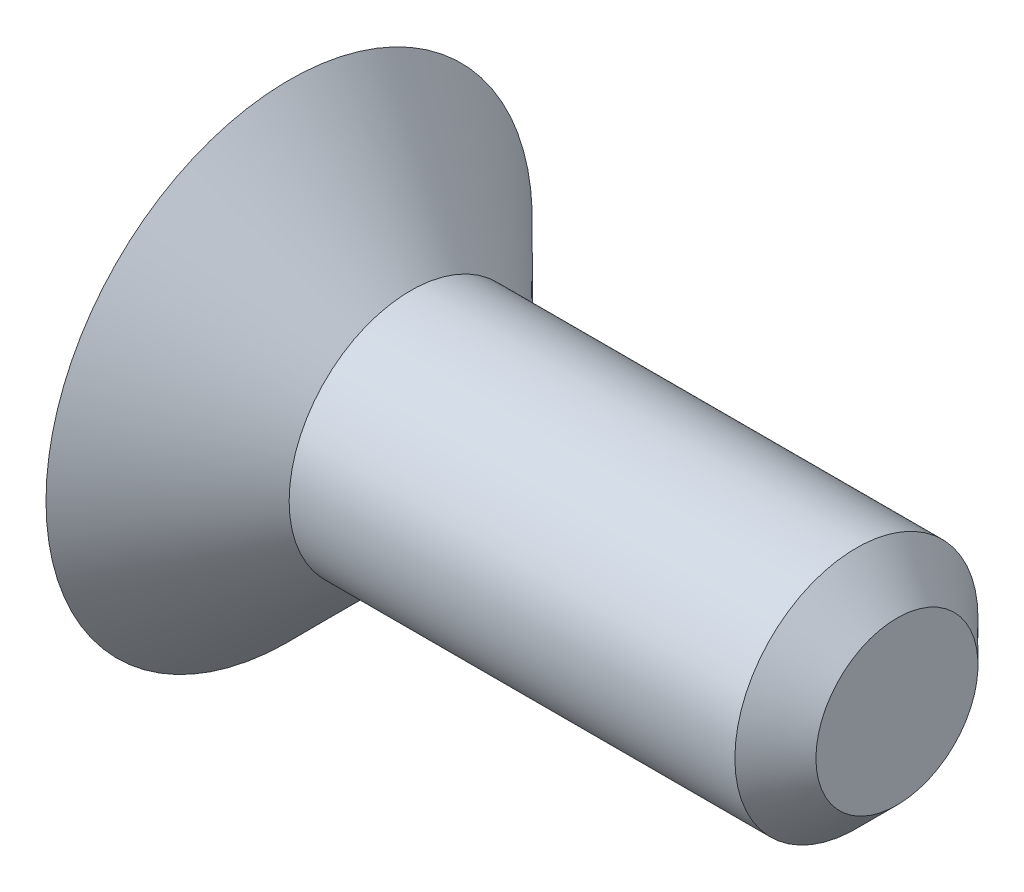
SolidWorks part; units mm, degrees
ref_plane "Face" through (0, 0, 0) normal (0, 0, 1) x (1, 0, 0)
ref_plane "Dessus" through (0, 0, 0) normal (0, 1, 0) x (1, 0, 0)
ref_plane "Droite" through (0, 0, 0) normal (1, 0, 0) x (0, 0, -1)
sketch "Esquisse1" plane through (0, 0, 0) normal (0, 0, 1) x (1, 0, 0)
  line L0 (1.5, 1.5) -> (7, 1.5)
  line L1 (7.5, 1) -> (7.5, 0)
  line L2 (1.5, 1.5) -> (0, 3)
  line L3 (0, 3) -> (0, 0)
  line L4 (-5.0682, 0) -> (13.7136, 0) construction
  line L5 (7, 1.5) -> (7.5, 1)
  line L6 (0, 0) -> (7.5, 0)
  dimension "D1" = 45
  dimension "D2" = 3
  dimension "D3" = 6
  dimension "D4" = 6
  dimension "D5" = 0.5
  dimension "D6" = 0.5
revolve "Base-Révolution" add sketch "Esquisse1" angle 360 about L4
sketch "Esquisse4" plane through (0, 0, 0) normal (-1, 0, 0) x (0, 0, 1)
  line L0 (0, -1.4434) -> (1.25, -0.7217)
  line L1 (1.25, -0.7217) -> (1.25, 0.7217)
  line L2 (1.25, 0.7217) -> (0, 1.4434)
  line L3 (0, 1.4434) -> (-1.25, 0.7217)
  line L4 (-1.25, 0.7217) -> (-1.25, -0.7217)
  line L5 (-1.25, -0.7217) -> (0, -1.4434)
  circle A0 centre (0, 0) radius 1.25 construction
  dimension "D1" = 2.5
extrude "Enlèv. mat.-Extru.3" cut sketch "Esquisse4" against normal blind 2
